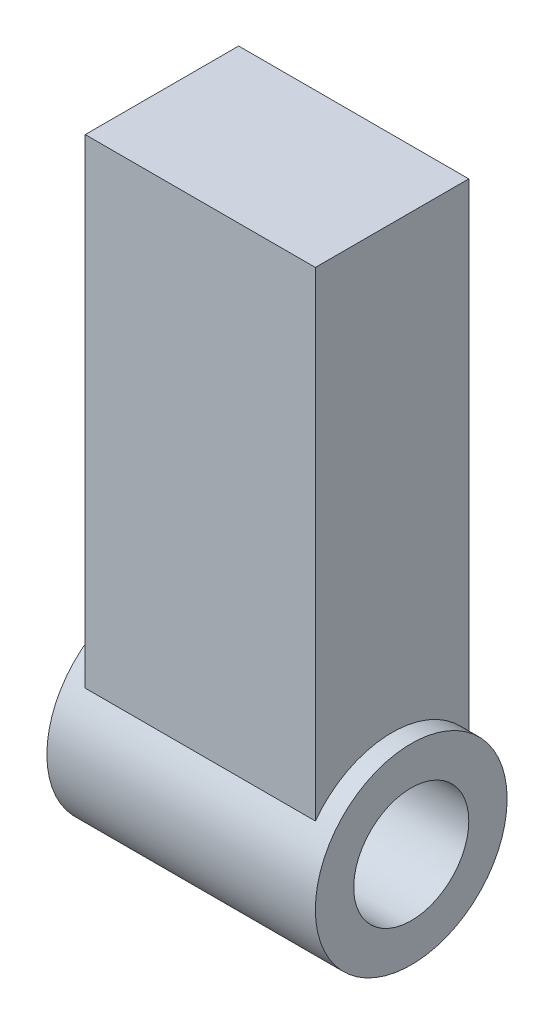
SolidWorks part; units mm, degrees
ref_plane "Vorne" through (0, 0, 0) normal (0, 0, 1) x (1, 0, 0)
ref_plane "Oben" through (0, 0, 0) normal (0, 1, 0) x (1, 0, 0)
ref_plane "Rechts" through (0, 0, 0) normal (1, 0, 0) x (0, 0, -1)
sketch "Skizze1" plane through (0, 0, 0) normal (0, 1, 0) x (1, 0, 0)
  line L1 (0, 0) -> (60, 0)
  line L2 (0, 0) -> (0, 40)
  line L3 (0, 40) -> (60, 40)
  line L4 (60, 0) -> (60, 40)
  dimension "D1" = 40
  dimension "D2" = 60
extrude "Linear austragen1" add sketch "Skizze1" along normal blind 100
sketch "Skizze2" plane through (0, 0, 0) normal (1, 0, 0) x (0, 0, -1)
  line L0 (0, 0) -> (40, 0) construction
  line L1 (20, -1000) -> (20, 49000) construction
  circle A0 centre (20, -40) radius 25
  circle A1 centre (20, -40) radius 15
  point P7 (20, 0)
  dimension "D1" = 50
  dimension "D3" = 30
  dimension "D2" = 40
extrude "Linear austragen2" add sketch "Skizze2" along normal blind 65 and the other way blind 5
sketch "Skizze3" plane through (0, 0, 0) normal (0, -1, 0) x (1, 0, 0)
  line L4 (0, 0) -> (0, -40)
  line L5 (0, -40) -> (60, -40)
  line L6 (60, -40) -> (60, 0)
  line L7 (60, 0) -> (0, 0)
  line L8 (0, 0) -> (0, -40)
  line L9 (0, -40) -> (60, -40)
  line L10 (60, -40) -> (60, 0)
  line L11 (60, 0) -> (0, 0)
  dimension "D1" = 0
extrude "Linear austragen3" add sketch "Skizze3" along normal up to surface (25 mm away)
